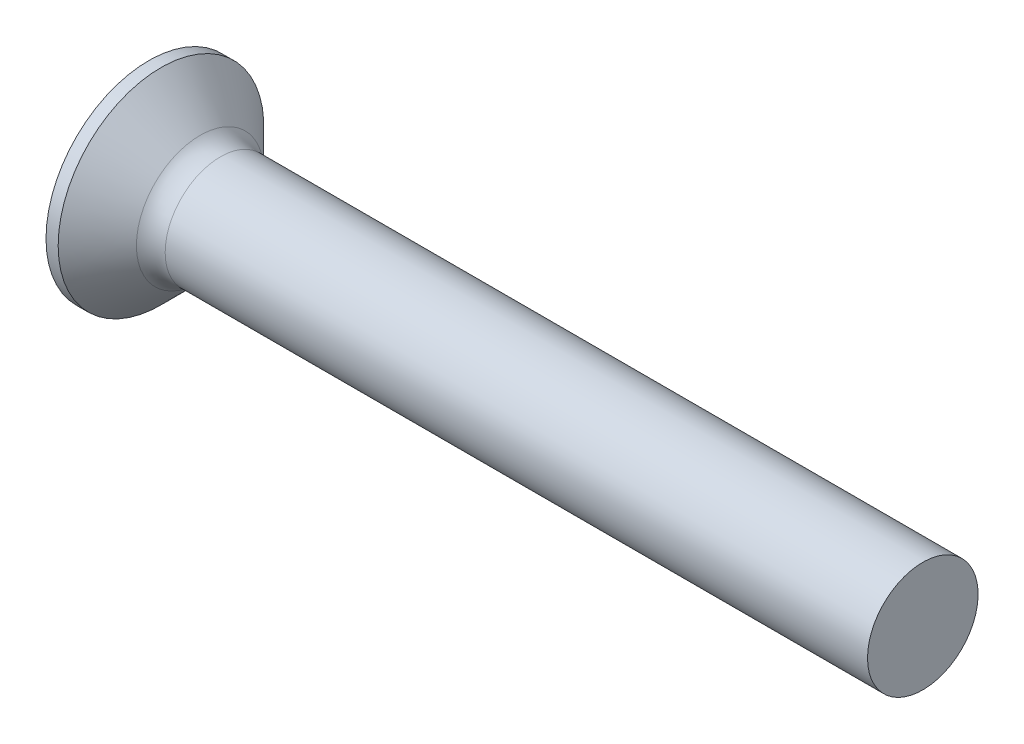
SolidWorks part; units mm, degrees
revolve "Base-Revolve" add sketch "BodySke" angle 360 about L5
sketch "BodySke" plane through (0, 0, 0) normal (0, 0, 1) x (1, 0, 0)
  line L0 (0, 0) -> (0, 4.65)
  line L1 (0, 4.65) -> (0.55, 4.65)
  line L2 (2.7, 2.5) -> (35, 2.5)
  line L3 (35, 2.5) -> (35, 0)
  line L4 (35, 0) -> (0, 0)
  line L5 (-6.35, 0) -> (82.55, 0) construction
  line L6 (2.7, -2.5) -> (35, -2.5) construction
  line L7 (0.55, -4.65) -> (2.7, -2.5) construction
  line L8 (0.55, 4.65) -> (2.7, 2.5)
  line L9 (0, -4.65) -> (0.55, -4.65) construction
  line L10 (3.5, 4.0875) -> (3.5, -5.4375) construction
  line L11 (0, 6.35) -> (0, -3.175) construction
ref_plane "Plane1" through (0, 0, 0) normal (0, 0, 1) x (1, 0, 0)
ref_plane "Plane2" through (0, 0, 0) normal (0, 1, 0) x (1, 0, 0)
ref_plane "Plane3" through (0, 0, 0) normal (1, 0, 0) x (0, 0, -1)
fillet "Fillet1" radius 1.3 1 edges at (2.7, 0, 2.5)
sketch "Sketch3" plane through (0, 0, 0) normal (-1, 0, 0) x (0, 0, 1)
  line L0 (-0.515, 2.45) -> (0.515, 2.45)
  line L1 (0.515, 2.45) -> (0.515, -2.45)
  line L2 (0.515, -2.45) -> (-0.515, -2.45)
  line L3 (-0.515, -2.45) -> (-0.515, 2.45)
ref_plane "Plane4" through (3.05, 0, 0) normal (-1, 0, 0) x (0, 0, 1)
sketch "Sketch4" plane through (3.05, 0, 0) normal (-1, 0, 0) x (0, 0, 1)
  line L0 (-0.515, 0.9293) -> (0.515, 0.9293)
  line L3 (0.515, 0.9293) -> (0.515, -0.9293)
  line L4 (0.515, -0.9293) -> (-0.515, -0.9293)
  line L5 (-0.515, -0.9293) -> (-0.515, 0.9293)
loft "Recess" cut profiles "Sketch3", "Sketch4"
pattern_circular "RecPat" count 2 every 90 about axis through (0, 0, 0) along (1, 0, 0) of "Recess"
sketch "RecCorSke" plane through (0, 0, 0) normal (0, 0, 1) x (1, 0, 0)
  line L0 (-3.175, 0) -> (15.875, 0) construction
  line L2 (0, 0) -> (0, 1.0643)
  line L3 (0, 1.0643) -> (3.05, 0.851)
  line L4 (3.05, 0.851) -> (3.3265, 0)
  line L5 (3.3265, 0) -> (0, 0)
revolve "RecessCore" cut sketch "RecCorSke" angle 360 about L0
sketch "ThdSchSke" plane through (0, 0, 0) normal (0, 0, 1) x (1, 0, 0)
  line L0 (3.5, -2.055) -> (3.1884, -2.5)
  line L1 (3.5, -2.055) -> (3.8116, -2.5)
  line L2 (3.8116, -2.5) -> (3.8116, -3.125)
  line L3 (-3.175, 0) -> (5.1513, 0) construction
  line L5 (3.8116, -3.125) -> (3.1884, -3.125)
  line L6 (3.1884, -3.125) -> (3.1884, -2.5)
  line L7 (0, 4.65) -> (0, -4.65) construction
revolve "ThreadSchematic" [suppressed] cut sketch "ThdSchSke" angle 360 about L3
pattern_linear "ThdSchPat" [suppressed]
equation "\"D1@Sketch3\" = \"Cross_dia@Sketch3\" / 2"
equation "\"D2@Sketch3\" = \"Cross_width@Sketch3\" / 2"
equation "\"Depth@RecCorSke\" = \"Cross_depth@Plane4\""
equation "\"D1@Sketch4\" = \"Cross_width@Sketch3\""
equation "\"D2@Sketch4\" = \"Cross_dia@Sketch3\" - 2.0 * \"Cross_depth@Plane4\" * tan(26.5  * 0.017453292)"
equation "\"D3@Sketch4\" = \"D1@Sketch4\" / 2"
equation "\"D4@Sketch4\" = \"D2@Sketch4\" / 2"
equation "\"Thread_length@ThreadCosmetic\" = ((sgn( (\"Length@BodySke\" - \"Advance@BodySke\" * 1.0 - \"Head_ht@BodySke\" ) - \"Thread_nom@BodySke\" )-1)*( (\"Length@BodySke\" - \"Advance@BodySke\" * 1.0 - \"Head_ht@BodySke\" "
equation "\"Thread_minor@ThdSchSke\" = \"Thread_minor@ThreadCosmetic\""
equation "\"Diameter@ThdSchSke\" = \"Diameter@BodySke\""
equation "\"Overcut@ThdSchSke\" = \"Diameter@BodySke\" * 1.25"
equation "\"Start@ThdSchSke\" = 0.000001 + \"Length@BodySke\" - \"Thread_length@ThreadCosmetic\"  '---Countersunk---"
equation "\"Num_threads@ThdSchPat\" = int( \"Thread_length@ThreadCosmetic\" / \"Advance@BodySke\" + 0.999 )  + 1"
equation "\"Advance@ThdSchPat\" = \"Thread_length@ThreadCosmetic\" /  (\"Num_threads@ThdSchPat\" - 1) 'relax it"
